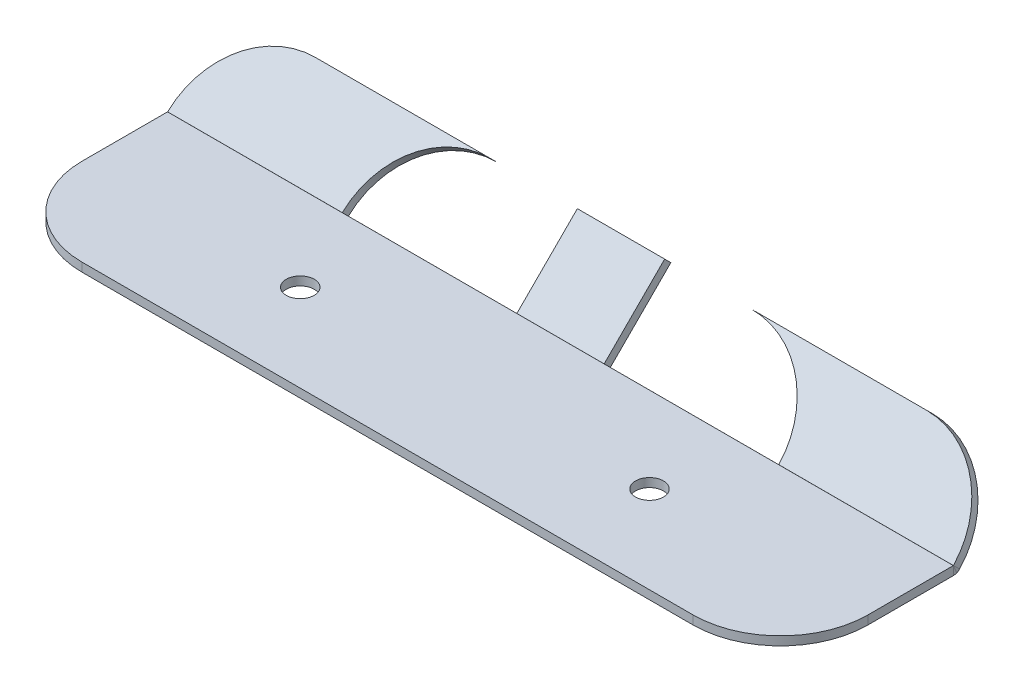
SolidWorks part; units mm, degrees
ref_plane "Front" through (0, 0, 0) normal (0, 0, 1) x (1, 0, 0)
ref_plane "Top" through (0, 0, 0) normal (0, 1, 0) x (1, 0, 0)
ref_plane "Right" through (0, 0, 0) normal (1, 0, 0) x (0, 0, -1)
sketch "Sketch1" plane through (0, 0, 0) normal (0, 1, 0) x (1, 0, 0)
  line L0 (20, 20) -> (40, 20)
  line L1 (10, 0) -> (80, 0)
  line L2 (0, 10) -> (0, 20)
  line L3 (10, 30) -> (30, 30)
  line L4 (90, 10) -> (90, 20)
  line L5 (45, 0) -> (45, 30) construction
  line L6 (50, 20) -> (70, 20)
  line L7 (50, 20) -> (50, 30)
  line L8 (40, 20) -> (40, 30)
  line L9 (60, 30) -> (80, 30)
  line L10 (40, 30) -> (50, 30)
  circle A0 centre (65, 10) radius 1.6
  circle A1 centre (25, 10) radius 1.6
  arc A2 (90, 20) -> (80, 30) centre (80, 20) ccw
  arc A3 (0, 20) -> (10, 30) centre (10, 20) cw
  arc A4 (10, 0) -> (0, 10) centre (10, 10) cw
  arc A5 (90, 10) -> (80, 0) centre (80, 10) cw
  arc A6 (70, 20) -> (60, 30) centre (60, 20) ccw
  arc A7 (30, 30) -> (20, 20) centre (30, 20) ccw
  point P17 (0, 0)
  dimension "D1" = 40
sheet metal parameters "Sheet-Metal1" thickness 1 parameters "D1"=0.01
base flange "Base-Flange1" sketch "Sketch1" thickness 1 reverse thickness direction yes parameters "D1"=0.01
sketch "Sketch3" plane through (0, 1, 0) normal (0, 1, 0) x (-1, 0, 0)
  line L1 (-10, -20) -> (-80, -20)
sketched bend "Sketched Bend1" parameters "D1"=0.7366
bend "SketchBend1" bend radius 0.01 bend angle 45 parameters "D5"=1
flat pattern "Flat-Pattern1"
sketch "Bend-Lines1" plane through (0, 0, 0) normal (0, 1, 0) x (-1, 0, 0)
bend of the flat pattern "Flatten-<SketchBend1>1"
